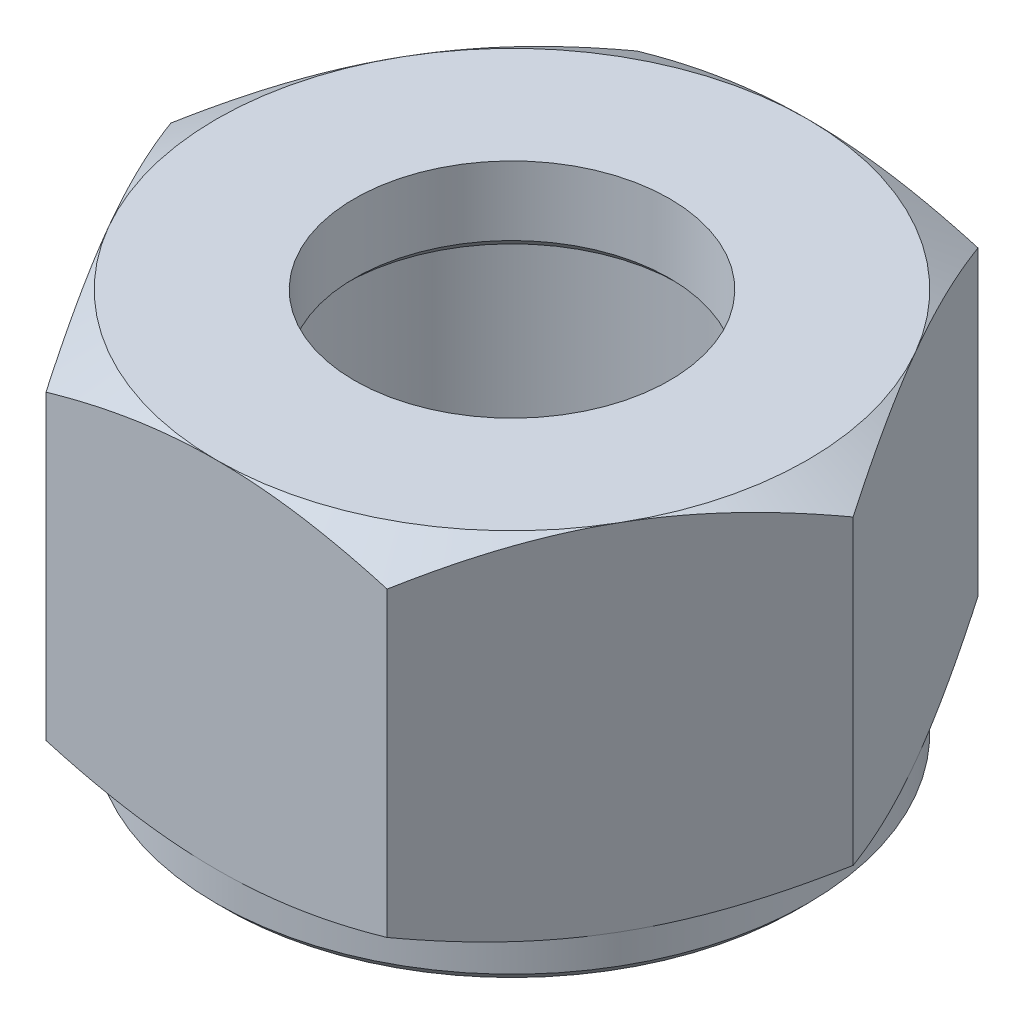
SolidWorks part; units mm, degrees
ref_plane "Přední rovina" through (0, 0, 0) normal (0, 0, 1) x (1, 0, 0)
ref_plane "Horní rovina" through (0, 0, 0) normal (0, 1, 0) x (1, 0, 0)
ref_plane "Pravá rovina" through (0, 0, 0) normal (1, 0, 0) x (0, 0, -1)
sketch "Skica1" plane through (0, 0, 0) normal (0, 1, 0) x (1, 0, 0)
  line L1 (17.3205, 0) -> (8.6603, 15)
  line L2 (8.6603, 15) -> (-8.6603, 15)
  line L3 (-8.6603, 15) -> (-17.3205, 0)
  line L4 (-17.3205, 0) -> (-8.6603, -15)
  line L5 (-8.6603, -15) -> (8.6603, -15)
  line L6 (8.6603, -15) -> (17.3205, 0)
  circle A0 centre (0, 0) radius 15 construction
extrude "Přidat vysunutím1" add sketch "Skica1" along normal blind 18
sketch "Skica2" plane through (0, 18, 0) normal (0, 1, 0) x (-1, 0, 0)
  circle A0 centre (0, 0) radius 15
extrude "Odebrat vysunutím1" cut sketch "Skica2" against normal blind 18 draft 60 flip side to cut
sketch "Skica3" plane through (0, 0, 0) normal (0, -1, 0) x (1, 0, 0)
  circle A0 centre (0, 0) radius 15
extrude "Odebrat vysunutím2" cut sketch "Skica3" against normal blind 18 draft 60 flip side to cut
sketch "Skica4" plane through (0, 0, 0) normal (0, -1, 0) x (1, 0, 0)
  circle A0 centre (0, 0) radius 15
extrude "Přidat vysunutím2" add sketch "Skica4" along normal blind 2
chamfer "Zkosení1" distance 0.5 angle 45 1 edges at (0, -2, -15)
sketch "Skica5" plane through (0, -2, 0) normal (0, -1, 0) x (1, 0, 0)
  circle A0 centre (0, 0) radius 11
extrude "Odebrat vysunutím3" cut sketch "Skica5" against normal blind 16
sketch "Skica6" plane through (0, 18, 0) normal (0, 1, 0) x (1, 0, 0)
  circle A0 centre (0, 0) radius 8
extrude "Odebrat vysunutím4" cut sketch "Skica6" against normal up to next
chamfer "Zkosení2" distance 0.5 angle 45 1 edges at (0, 14, -8)
